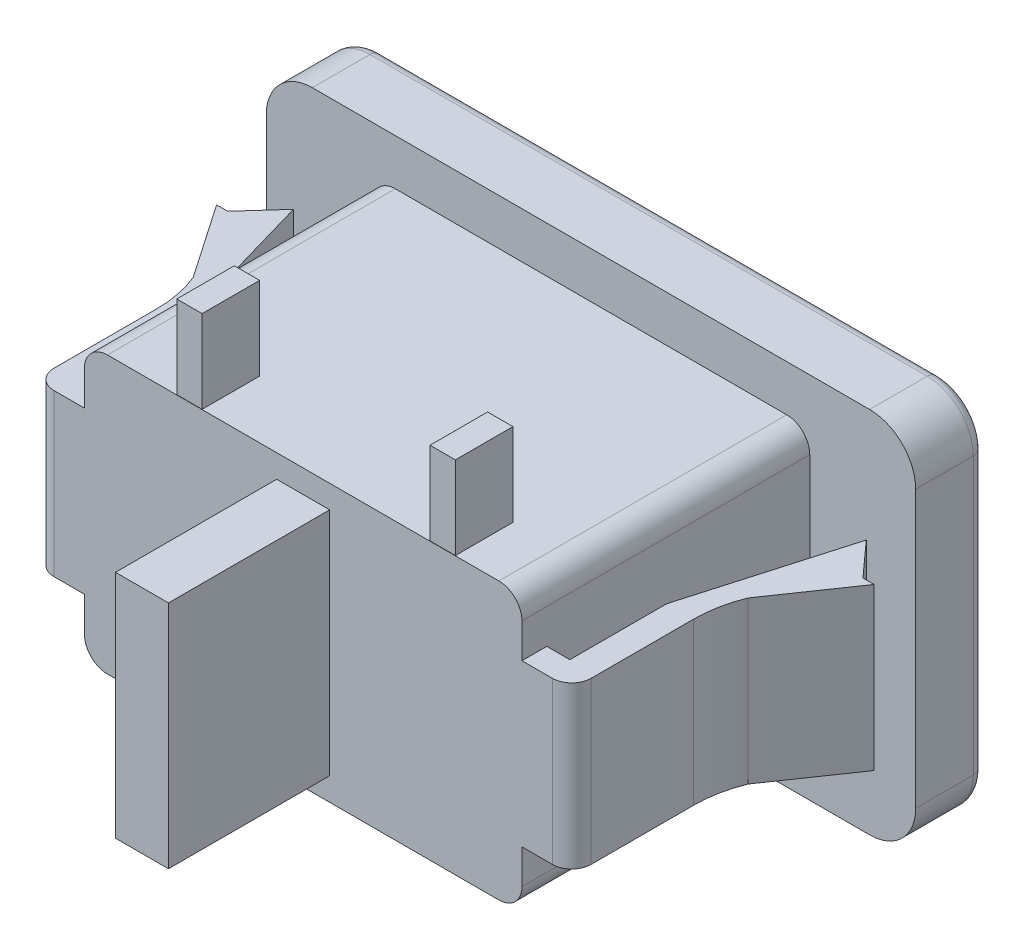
SolidWorks part; units mm, degrees
ref_plane "Front Plane" through (0, 0, 0) normal (0, 0, 1) x (1, 0, 0)
ref_plane "Top Plane" through (0, 0, 0) normal (0, 1, 0) x (1, 0, 0)
ref_plane "Center Plane" through (0, 0, 0) normal (1, 0, 0) x (0, 0, -1)
sketch "Sketch8" plane through (0, 0, 0) normal (0, 0, 1) x (1, 0, 0)
  line L0 (-1.1792, 0) -> (-1.2283, 0.4422)
  line L1 (-1.2283, 0.4422) -> (-1.2774, 0.737)
  line L2 (-1.3266, 0.8844) -> (-1.3757, 0.9826)
  line L3 (-1.4248, 1.13) -> (-1.474, 1.2774)
  line L4 (-1.474, 1.2774) -> (-1.6705, 1.6705)
  line L5 (-1.6705, 1.6705) -> (-1.7688, 1.7688)
  line L6 (-1.867, 1.9161) -> (-1.9161, 2.0144)
  line L7 (-2.0144, 2.0635) -> (-2.2601, 2.3583)
  line L8 (-2.2601, 2.3583) -> (-2.604, 2.604)
  line L9 (-2.7023, 2.6531) -> (-2.8005, 2.7023)
  line L10 (-2.9479, 2.8005) -> (-3.0462, 2.8497)
  line L11 (-3.0462, 2.8497) -> (-3.4392, 2.997)
  line L12 (-3.4392, 2.997) -> (-3.6849, 3.0462)
  line L13 (-3.7832, 3.0953) -> (-3.8814, 3.0953)
  line L14 (-3.8814, 3.0953) -> (-3.9306, 3.0953)
  line L15 (-4.0288, 3.0953) -> (-4.3236, 3.1444)
  line L16 (-4.3236, 3.1444) -> (-4.7658, 3.0953)
  line L17 (-4.7658, 3.0953) -> (-4.8149, 3.0953)
  line L18 (-4.9623, 3.0462) -> (-5.0606, 3.0462)
  line L19 (-5.208, 2.997) -> (-5.6502, 2.8497)
  line L20 (-5.6502, 2.8497) -> (-5.8958, 2.7023)
  line L21 (-6.0432, 2.6531) -> (-6.1415, 2.5549)
  line L22 (-6.2398, 2.4566) -> (-6.3872, 2.3583)
  line L23 (-6.3872, 2.3583) -> (-6.7311, 2.0144)
  line L24 (-6.7311, 2.0144) -> (-6.7802, 1.9653)
  line L25 (-6.8785, 1.8179) -> (-6.9276, 1.7196)
  line L26 (-7.0259, 1.6214) -> (-7.2224, 1.2774)
  line L27 (-7.2224, 1.2774) -> (-7.3207, 0.9335)
  line L28 (-7.3698, 0.8352) -> (-7.4189, 0.6878)
  line L29 (-7.4189, 0.5405) -> (-7.4681, 0.4422)
  line L30 (-7.4681, 0.4422) -> (-7.5172, 0)
  line L31 (-7.5172, 0) -> (-7.4681, -0.1965)
  line L32 (-7.4681, -0.3439) -> (-7.4681, -0.4913)
  line L33 (-7.4189, -0.5896) -> (-7.3698, -0.9335)
  line L34 (-7.3698, -0.9335) -> (-7.2224, -1.3266)
  line L35 (-7.2224, -1.3266) -> (-7.1733, -1.3266)
  line L36 (-7.1241, -1.474) -> (-7.075, -1.5722)
  line L37 (-7.0259, -1.6705) -> (-6.9767, -1.7196)
  line L38 (-6.9767, -1.7196) -> (-6.7311, -2.0635)
  line L39 (-6.7311, -2.0635) -> (-6.5345, -2.2601)
  line L40 (-6.4363, -2.3583) -> (-6.338, -2.4566)
  line L41 (-6.2398, -2.5057) -> (-6.0432, -2.6531)
  line L42 (-6.0432, -2.6531) -> (-5.6502, -2.8988)
  line L43 (-5.6502, -2.8988) -> (-5.5519, -2.8988)
  line L44 (-5.4536, -2.9479) -> (-5.3062, -2.997)
  line L45 (-5.208, -3.0462) -> (-4.7658, -3.1444)
  line L46 (-4.7658, -3.1444) -> (-4.4219, -3.1444)
  line L47 (-4.3236, -3.1936) -> (-4.1762, -3.1444)
  line L48 (-4.0288, -3.1444) -> (-3.8814, -3.1444)
  line L49 (-3.8814, -3.1444) -> (-3.4392, -3.0462)
  line L50 (-3.4392, -3.0462) -> (-3.2918, -2.997)
  line L51 (-3.1936, -2.9479) -> (-3.0462, -2.8988)
  line L52 (-2.9479, -2.8497) -> (-2.6531, -2.6531)
  line L53 (-2.6531, -2.6531) -> (-2.3092, -2.4075)
  line L54 (-2.2109, -2.3583) -> (-2.1127, -2.2109)
  line L55 (-2.0144, -2.1618) -> (-1.9653, -2.0635)
  line L56 (-1.9653, -2.0635) -> (-1.6705, -1.7196)
  line L57 (-1.6705, -1.7196) -> (-1.5722, -1.5231)
  line L58 (-1.474, -1.3757) -> (-1.474, -1.3266)
  line L59 (-1.474, -1.3266) -> (-1.4248, -1.2774)
  line L60 (-1.4248, -1.1792) -> (-1.3266, -0.9335)
  line L61 (-1.3266, -0.9335) -> (-1.2283, -0.4913)
  line L62 (-1.2283, -0.4913) -> (-1.2283, -0.3931)
  line L64 (-3.1936, 0) -> (-3.1936, 0.2457)
  line L65 (-3.1936, 0.2457) -> (-3.2918, 0.4913)
  line L66 (-3.2918, 0.4913) -> (-3.4392, 0.6878)
  line L67 (-3.5375, 0.8352) -> (-3.6358, 0.8844)
  line L68 (-3.7832, 0.9826) -> (-3.8323, 1.0318)
  line L69 (-3.8323, 1.0318) -> (-4.078, 1.0809)
  line L70 (-4.078, 1.0809) -> (-4.3236, 1.13)
  line L71 (-4.3236, 1.13) -> (-4.5201, 1.0809)
  line L72 (-4.6675, 1.0809) -> (-4.7658, 1.0318)
  line L73 (-4.9132, 0.9826) -> (-5.0606, 0.8844)
  line L74 (-5.0606, 0.8844) -> (-5.208, 0.6878)
  line L75 (-5.208, 0.6878) -> (-5.3554, 0.4913)
  line L76 (-5.3554, 0.4913) -> (-5.4045, 0.3931)
  line L77 (-5.4536, 0.2457) -> (-5.4536, 0.0983)
  line L78 (-5.5028, 0) -> (-5.4536, -0.2948)
  line L79 (-5.4536, -0.2948) -> (-5.3554, -0.5405)
  line L80 (-5.3554, -0.5405) -> (-5.208, -0.737)
  line L81 (-5.1097, -0.8352) -> (-5.0606, -0.9335)
  line L82 (-5.0606, -0.9335) -> (-5.0115, -0.9335)
  line L83 (-4.9132, -1.0318) -> (-4.8641, -1.0809)
  line L84 (-4.8641, -1.0809) -> (-4.5693, -1.13)
  line L85 (-4.5693, -1.13) -> (-4.3236, -1.1792)
  line L86 (-4.3236, -1.1792) -> (-4.1271, -1.13)
  line L87 (-4.0288, -1.13) -> (-3.8814, -1.0809)
  line L88 (-3.7832, -1.0318) -> (-3.6358, -0.9335)
  line L89 (-3.6358, -0.9335) -> (-3.4392, -0.737)
  line L90 (-3.4392, -0.737) -> (-3.2918, -0.5405)
  line L91 (-3.2918, -0.5405) -> (-3.2427, -0.4422)
  line L92 (-3.1936, -0.2948) -> (-3.1936, -0.1474)
  line L93 (-4.471, 4.2253) -> (-5.0115, 4.1762)
  line L94 (-5.0115, 4.1762) -> (-5.1589, 4.1762)
  line L95 (-5.3062, 4.1271) -> (-5.4045, 4.1271)
  line L96 (-5.5519, 4.078) -> (-5.601, 4.0288)
  line L97 (-5.601, 4.0288) -> (-6.1415, 3.8323)
  line L98 (-6.1415, 3.8323) -> (-6.2398, 3.7832)
  line L99 (-6.338, 3.734) -> (-6.4363, 3.6849)
  line L100 (-6.5837, 3.5866) -> (-6.6328, 3.5866)
  line L101 (-6.6328, 3.5866) -> (-7.075, 3.2427)
  line L102 (-7.075, 3.2427) -> (-7.1733, 3.1444)
  line L103 (-7.2715, 3.0462) -> (-7.3698, 2.9479)
  line L104 (-7.4189, 2.8988) -> (-7.5172, 2.8497)
  line L105 (-7.5172, 2.8497) -> (-7.8611, 2.4075)
  line L106 (-7.8611, 2.4075) -> (-7.9102, 2.3092)
  line L107 (-7.9594, 2.2109) -> (-8.0085, 2.0635)
  line L108 (-8.1068, 1.9653) -> (-8.1068, 1.9161)
  line L109 (-8.1068, 1.9161) -> (-8.3524, 1.3757)
  line L110 (-8.3524, 1.3757) -> (-8.4016, 1.2774)
  line L111 (-8.4016, 1.13) -> (-8.4507, 1.0318)
  line L112 (-8.4998, 0.9335) -> (-8.4998, 0.8352)
  line L113 (-8.4998, 0.8352) -> (-8.5981, 0.2457)
  line L114 (-8.5981, 0.2457) -> (-8.5981, 0.1474)
  line L115 (-8.5981, 0.0491) -> (-8.5981, -0.0983)
  line L116 (-8.5981, -0.1965) -> (-8.5981, -0.2948)
  line L117 (-8.5981, -0.2948) -> (-8.4998, -0.8844)
  line L118 (-8.4998, -0.8844) -> (-8.4998, -0.9335)
  line L119 (-8.4507, -1.0809) -> (-8.4016, -1.1792)
  line L120 (-8.4016, -1.3266) -> (-8.3524, -1.4248)
  line L121 (-8.3524, -1.4248) -> (-8.1068, -1.9653)
  line L122 (-8.1068, -1.9653) -> (-8.1068, -2.0144)
  line L123 (-8.0085, -2.1127) -> (-7.9594, -2.2601)
  line L124 (-7.9102, -2.3583) -> (-7.8611, -2.4566)
  line L125 (-7.8611, -2.4566) -> (-7.5172, -2.8988)
  line L126 (-7.5172, -2.8988) -> (-7.4189, -2.9479)
  line L127 (-7.3698, -3.0462) -> (-7.2715, -3.0953)
  line L128 (-7.1733, -3.1936) -> (-7.075, -3.2918)
  line L129 (-7.075, -3.2918) -> (-6.6328, -3.6358)
  line L130 (-6.6328, -3.6358) -> (-6.5837, -3.6849)
  line L131 (-6.4363, -3.734) -> (-6.338, -3.7832)
  line L132 (-6.2398, -3.8323) -> (-6.1415, -3.9306)
  line L133 (-6.1415, -3.9306) -> (-5.601, -4.1271)
  line L134 (-5.601, -4.1271) -> (-5.5519, -4.1271)
  line L135 (-5.4045, -4.1762) -> (-5.3062, -4.1762)
  line L136 (-5.1589, -4.2253) -> (-5.0115, -4.2253)
  line L137 (-5.0115, -4.2253) -> (-4.471, -4.2745)
  line L138 (-9.2859, 0) -> (-8.4016, 0)
  line L139 (-8.1559, 0) -> (-7.9102, 0)
  line L140 (-7.6646, 0) -> (-6.3872, 0)
  line L141 (-6.1415, 0) -> (-5.8958, 0)
  line L142 (-5.6502, 0) -> (-4.4219, 0)
  line L143 (-4.1271, 0) -> (-3.8814, 0)
  line L144 (-3.6358, 0) -> (-2.3583, 0)
  line L145 (-2.1127, 0) -> (-1.867, 0)
  line L150 (2.4075, 0) -> (3.6849, 0)
  line L151 (3.9306, 0) -> (4.1762, 0)
  line L152 (4.4219, 0) -> (5.6993, 0)
  line L153 (5.945, 0) -> (6.1906, 0)
  line L154 (6.4363, 0) -> (7.7137, 0)
  line L155 (7.9594, 0) -> (8.205, 0)
  line L156 (8.4507, 0) -> (9.2859, 0)
  line L157 (-6.2889, 0.7861) -> (-6.2889, 0.1474)
  line L158 (-6.2889, 0.0491) -> (-6.2889, -0.0983)
  line L159 (-6.2889, -0.1965) -> (-6.2889, -0.8352)
  line L160 (-6.2889, -0.8352) -> (-5.1589, -0.8352)
  line L161 (-6.2889, 0.7861) -> (-5.1589, 0.7861)
  line L162 (6.338, 0.7861) -> (6.338, 0.1474)
  line L163 (6.338, 0.0491) -> (6.338, -0.0983)
  line L164 (6.338, -0.1965) -> (6.338, -0.8352)
  line L165 (7.5172, 0) -> (7.4681, 0.4422)
  line L166 (7.4681, 0.4422) -> (7.4189, 0.737)
  line L167 (7.4189, 0.8844) -> (7.3698, 0.9826)
  line L168 (7.2715, 1.13) -> (7.2224, 1.2774)
  line L169 (7.2224, 1.2774) -> (7.0259, 1.6705)
  line L170 (7.0259, 1.6705) -> (6.9276, 1.7687)
  line L171 (6.8293, 1.9161) -> (6.7802, 2.0144)
  line L172 (6.6819, 2.0635) -> (6.4363, 2.3583)
  line L173 (6.4363, 2.3583) -> (6.0924, 2.604)
  line L174 (5.9941, 2.6531) -> (5.8958, 2.7023)
  line L175 (5.7484, 2.8005) -> (5.6993, 2.8497)
  line L176 (5.6993, 2.8497) -> (5.2571, 2.997)
  line L177 (5.2571, 2.997) -> (5.0606, 3.0462)
  line L178 (4.9132, 3.0953) -> (4.8149, 3.0953)
  line L179 (4.8149, 3.0953) -> (4.7658, 3.0953)
  line L180 (4.6675, 3.0953) -> (4.3727, 3.1444)
  line L181 (4.3727, 3.1444) -> (3.9306, 3.0953)
  line L182 (3.9306, 3.0953) -> (3.8814, 3.0953)
  line L183 (3.734, 3.0462) -> (3.6358, 3.0462)
  line L184 (3.4884, 2.997) -> (3.0462, 2.8497)
  line L185 (3.0462, 2.8497) -> (2.8005, 2.7023)
  line L186 (2.6531, 2.6531) -> (2.5549, 2.5549)
  line L187 (2.5057, 2.4566) -> (2.3092, 2.3583)
  line L188 (2.3092, 2.3583) -> (1.9653, 2.0144)
  line L189 (1.9653, 2.0144) -> (1.9161, 1.9653)
  line L190 (1.867, 1.8179) -> (1.7688, 1.7196)
  line L191 (1.6705, 1.6214) -> (1.5231, 1.2774)
  line L192 (1.5231, 1.2774) -> (1.3757, 0.9335)
  line L193 (1.3266, 0.8352) -> (1.2774, 0.6878)
  line L197 (1.2283, -0.3439) -> (1.2283, -0.4913)
  line L198 (1.2774, -0.5896) -> (1.3266, -0.9335)
  line L199 (1.3266, -0.9335) -> (1.5231, -1.3266)
  line L200 (1.5722, -1.474) -> (1.6214, -1.5722)
  line L201 (1.6705, -1.6705) -> (1.7196, -1.7196)
  line L202 (1.7196, -1.7196) -> (1.9653, -2.0635)
  line L203 (1.9653, -2.0635) -> (2.1618, -2.2601)
  line L204 (2.2601, -2.3583) -> (2.3092, -2.4075)
  line L205 (2.3092, -2.4075) -> (2.3583, -2.4566)
  line L206 (2.5057, -2.5057) -> (2.6531, -2.6531)
  line L207 (2.6531, -2.6531) -> (3.0462, -2.8988)
  line L208 (3.0462, -2.8988) -> (3.1444, -2.8988)
  line L209 (3.2427, -2.9479) -> (3.3901, -2.997)
  line L210 (3.4884, -3.0462) -> (3.9306, -3.1444)
  line L211 (3.9306, -3.1444) -> (4.2745, -3.1444)
  line L212 (4.4219, -3.1936) -> (4.5201, -3.1444)
  line L213 (4.6675, -3.1444) -> (4.8149, -3.1444)
  line L214 (4.8149, -3.1444) -> (5.2571, -3.0462)
  line L215 (5.2571, -3.0462) -> (5.4045, -2.997)
  line L216 (5.5519, -2.9479) -> (5.6502, -2.8988)
  line L217 (5.7484, -2.8497) -> (6.0924, -2.6531)
  line L218 (6.0924, -2.6531) -> (6.4363, -2.4075)
  line L219 (6.5345, -2.3583) -> (6.5837, -2.2109)
  line L220 (6.6819, -2.1618) -> (6.7311, -2.0635)
  line L221 (6.7311, -2.0635) -> (7.0259, -1.7196)
  line L222 (7.0259, -1.7196) -> (7.1241, -1.5231)
  line L223 (7.2224, -1.3757) -> (7.2224, -1.3266)
  line L224 (7.2224, -1.3266) -> (7.2715, -1.2774)
  line L225 (7.2715, -1.1792) -> (7.4189, -0.9335)
  line L226 (7.4189, -0.9335) -> (7.4681, -0.4913)
  line L227 (7.4681, -0.4913) -> (7.4681, -0.3931)
  line L228 (7.5172, -0.2948) -> (7.5172, -0.1474)
  line L229 (5.5028, 0) -> (5.5028, 0.2457)
  line L230 (5.5028, 0.2457) -> (5.4045, 0.4913)
  line L231 (5.4045, 0.4913) -> (5.2571, 0.6878)
  line L232 (5.1589, 0.8352) -> (5.0606, 0.8844)
  line L233 (4.9623, 0.9826) -> (4.8641, 1.0318)
  line L234 (4.8641, 1.0318) -> (4.6184, 1.0809)
  line L235 (4.6184, 1.0809) -> (4.3727, 1.13)
  line L236 (4.3727, 1.13) -> (4.1762, 1.0809)
  line L237 (4.0288, 1.0809) -> (3.9306, 1.0318)
  line L238 (3.7832, 0.9826) -> (3.6358, 0.8844)
  line L239 (3.6358, 0.8844) -> (3.4884, 0.6878)
  line L240 (3.4884, 0.6878) -> (3.341, 0.4913)
  line L241 (3.341, 0.4913) -> (3.2918, 0.3931)
  line L242 (3.2427, 0.2457) -> (3.2427, 0.0983)
  line L243 (3.2427, 0) -> (3.2427, -0.2948)
  line L244 (3.2427, -0.2948) -> (3.341, -0.5405)
  line L245 (3.341, -0.5405) -> (3.4884, -0.737)
  line L246 (3.5866, -0.8352) -> (3.6358, -0.9335)
  line L247 (3.6358, -0.9335) -> (3.6849, -0.9335)
  line L248 (3.7832, -1.0318) -> (3.8814, -1.0809)
  line L249 (3.8814, -1.0809) -> (4.1271, -1.13)
  line L250 (4.1271, -1.13) -> (4.3727, -1.1792)
  line L251 (4.3727, -1.1792) -> (4.5693, -1.13)
  line L252 (4.7167, -1.13) -> (4.8149, -1.0809)
  line L253 (4.9623, -1.0318) -> (5.0606, -0.9335)
  line L254 (5.0606, -0.9335) -> (5.2571, -0.737)
  line L255 (5.2571, -0.737) -> (5.4045, -0.5405)
  line L256 (5.4045, -0.5405) -> (5.4536, -0.4422)
  line L257 (5.5028, -0.2948) -> (5.5028, -0.1474)
  line L258 (4.5201, -4.2745) -> (5.0606, -4.2253)
  line L259 (5.0606, -4.2253) -> (5.208, -4.2253)
  line L260 (5.3062, -4.1762) -> (5.4536, -4.1762)
  line L261 (5.5519, -4.1271) -> (5.6502, -4.1271)
  line L262 (5.6502, -4.1271) -> (6.1415, -3.9306)
  line L263 (6.1415, -3.9306) -> (6.2889, -3.8323)
  line L264 (6.3872, -3.7832) -> (6.4854, -3.734)
  line L265 (6.5837, -3.6849) -> (6.6328, -3.6358)
  line L266 (6.6328, -3.6358) -> (7.1241, -3.2918)
  line L267 (7.1241, -3.2918) -> (7.2224, -3.1936)
  line L268 (7.2715, -3.0953) -> (7.3698, -3.0462)
  line L269 (7.4681, -2.9479) -> (7.5172, -2.8988)
  line L270 (7.5172, -2.8988) -> (7.8611, -2.4566)
  line L271 (7.8611, -2.4566) -> (7.9102, -2.3583)
  line L272 (8.0085, -2.2601) -> (8.0576, -2.1127)
  line L273 (8.1068, -2.0144) -> (8.1559, -1.9653)
  line L274 (8.1559, -1.9653) -> (8.4016, -1.4248)
  line L275 (8.4016, -1.4248) -> (8.4016, -1.3266)
  line L276 (8.4507, -1.1792) -> (8.4998, -1.0809)
  line L277 (8.4998, -0.9335) -> (8.549, -0.8844)
  line L278 (8.549, -0.8844) -> (8.5981, -0.2948)
  line L279 (8.5981, -0.2948) -> (8.5981, -0.1965)
  line L280 (8.5981, -0.0983) -> (8.5981, 0.0491)
  line L281 (8.5981, 0.1474) -> (8.5981, 0.2457)
  line L282 (8.5981, 0.2457) -> (8.549, 0.8352)
  line L283 (8.549, 0.8352) -> (8.4998, 0.9335)
  line L284 (8.4998, 1.0318) -> (8.4507, 1.13)
  line L285 (8.4016, 1.2774) -> (8.4016, 1.3757)
  line L286 (8.4016, 1.3757) -> (8.1559, 1.9161)
  line L287 (8.1559, 1.9161) -> (8.1068, 1.9653)
  line L288 (8.0576, 2.0635) -> (8.0085, 2.2109)
  line L289 (7.9102, 2.3092) -> (7.8611, 2.4075)
  line L290 (7.8611, 2.4075) -> (7.5172, 2.8497)
  line L291 (7.5172, 2.8497) -> (7.4681, 2.8988)
  line L292 (7.3698, 2.9479) -> (7.2715, 3.0462)
  line L293 (7.2224, 3.1444) -> (7.1241, 3.2427)
  line L294 (7.1241, 3.2427) -> (6.6328, 3.5866)
  line L295 (6.6328, 3.5866) -> (6.5837, 3.5866)
  line L296 (6.4854, 3.6849) -> (6.3872, 3.734)
  line L297 (6.2889, 3.7832) -> (6.1415, 3.8323)
  line L298 (6.1415, 3.8323) -> (5.6502, 4.0288)
  line L299 (5.6502, 4.0288) -> (5.5519, 4.078)
  line L300 (5.4536, 4.1271) -> (5.3062, 4.1271)
  line L301 (5.208, 4.1762) -> (5.0606, 4.1762)
  line L302 (5.0606, 4.1762) -> (4.5201, 4.2253)
  line L303 (4.3727, -1.2774) -> (4.3727, -0.3931)
  line L304 (4.3727, -0.1474) -> (4.3727, 0.0983)
  line L305 (4.3727, 0.3439) -> (4.3727, 1.2283)
  line L306 (-4.3236, -1.2774) -> (-4.3236, -0.3931)
  line L307 (-4.3236, -0.1474) -> (-4.3236, 0.0983)
  line L308 (-4.3236, 0.3439) -> (-4.3236, 1.2283)
  line L313 (0, -1.4248) -> (0, -2.2109)
  line L314 (1.6705, -4.0288) -> (1.7687, -4.1762)
  line L315 (1.7687, -4.1762) -> (1.9653, -4.2745)
  line L316 (1.9653, -4.2745) -> (2.1127, -4.2745)
  line L317 (-0.8844, -2.7514) -> (-1.1792, -3.2427)
  line L318 (-1.2283, -3.341) -> (-1.3266, -3.4392)
  line L319 (-1.3757, -3.5375) -> (-1.6214, -4.0288)
  line L320 (-4.471, -4.2745) -> (-4.0288, -4.2745)
  line L321 (-3.8814, -4.2745) -> (-3.7832, -4.2745)
  line L322 (-3.6358, -4.2745) -> (-2.8988, -4.2745)
  line L323 (-2.7514, -4.2745) -> (-2.6531, -4.2745)
  line L324 (-2.5057, -4.2745) -> (-2.1127, -4.2745)
  line L325 (-2.1127, -4.2745) -> (-1.9161, -4.2745)
  line L326 (-1.9161, -4.2745) -> (-1.7688, -4.1762)
  line L327 (-1.7688, -4.1762) -> (-1.6214, -4.0288)
  line L328 (0.9335, -2.7514) -> (0.737, -2.5057)
  line L329 (0.737, -2.5057) -> (0.5405, -2.3583)
  line L330 (0.5405, -2.3583) -> (0.2948, -2.2601)
  line L331 (0.2948, -2.2601) -> (0.1965, -2.2601)
  line L332 (0.0983, -2.2109) -> (0, -2.2109)
  line L333 (0, -2.2109) -> (-0.0491, -2.2109)
  line L334 (-0.1474, -2.2601) -> (-0.2457, -2.2601)
  line L335 (-0.2457, -2.2601) -> (-0.4913, -2.3583)
  line L336 (-0.4913, -2.3583) -> (-0.737, -2.5057)
  line L337 (-0.737, -2.5057) -> (-0.8844, -2.7514)
  line L338 (0.9335, -2.7514) -> (1.2283, -3.2427)
  line L339 (1.2774, -3.341) -> (1.3266, -3.4392)
  line L340 (1.3757, -3.5375) -> (1.6705, -4.0288)
  line L341 (5.208, -0.8352) -> (6.338, -0.8352)
  line L342 (2.1127, -4.2745) -> (2.5549, -4.2745)
  line L343 (2.6531, -4.2745) -> (2.8005, -4.2745)
  line L344 (2.9479, -4.2745) -> (3.6849, -4.2745)
  line L345 (3.8323, -4.2745) -> (3.9306, -4.2745)
  line L346 (4.078, -4.2745) -> (4.5201, -4.2745)
  line L347 (2.1127, 4.2253) -> (1.9653, 4.2253)
  line L348 (1.9653, 4.2253) -> (1.7687, 4.1271)
  line L349 (1.7687, 4.1271) -> (1.6705, 3.9797)
  line L350 (-0.8844, 2.7023) -> (-1.1792, 3.1936)
  line L351 (-1.2283, 3.2918) -> (-1.3266, 3.3901)
  line L352 (-1.3757, 3.4884) -> (-1.6214, 3.9797)
  line L353 (-4.471, 4.2253) -> (-4.0288, 4.2253)
  line L354 (-3.8814, 4.2253) -> (-3.7832, 4.2253)
  line L355 (-3.6358, 4.2253) -> (-2.8988, 4.2253)
  line L356 (-2.7514, 4.2253) -> (-2.6531, 4.2253)
  line L357 (-2.5057, 4.2253) -> (-2.1127, 4.2253)
  line L358 (-1.6214, 3.9797) -> (-1.7688, 4.1271)
  line L359 (-1.7688, 4.1271) -> (-1.9161, 4.2253)
  line L360 (-1.9161, 4.2253) -> (-2.1127, 4.2253)
  line L361 (0.9335, 2.7023) -> (1.2283, 3.1936)
  line L362 (1.2774, 3.2918) -> (1.3266, 3.3901)
  line L363 (1.3757, 3.4884) -> (1.6705, 3.9797)
  line L364 (-0.8844, 2.7023) -> (-0.737, 2.4566)
  line L365 (-0.737, 2.4566) -> (-0.4913, 2.3092)
  line L366 (-0.4913, 2.3092) -> (-0.2457, 2.2109)
  line L370 (0.1965, 2.2109) -> (0.2948, 2.2109)
  line L371 (0.2948, 2.2109) -> (0.5405, 2.3092)
  line L372 (0.5405, 2.3092) -> (0.737, 2.4566)
  line L373 (0.737, 2.4566) -> (0.9335, 2.7023)
  line L374 (5.208, 0.7861) -> (6.338, 0.7861)
  line L375 (2.1127, 4.2253) -> (2.5549, 4.2253)
  line L376 (2.6531, 4.2253) -> (2.8005, 4.2253)
  line L377 (2.9479, 4.2253) -> (3.6849, 4.2253)
  line L378 (3.8323, 4.2253) -> (3.9306, 4.2253)
  line L379 (4.078, 4.2253) -> (4.5201, 4.2253)
  line L380 (9.2859, 0) -> (-9.2859, 0)
  line L381 (0, 5.4932) -> (0, -5.2033)
sketch "Sketch9" plane through (0, 0, 0) normal (0, 1, 0) x (1, 0, 0)
  line L90 (-5.4202, -13.599) -> (-5.4202, -12.6311)
  line L91 (2.3714, -12.6311) -> (2.3714, -15.2444)
  line L92 (5.4202, -12.9215) -> (5.4202, -12.6311)
  line L93 (5.2267, -12.9215) -> (5.2267, -13.599)
  line L94 (6.6301, -13.115) -> (6.6301, -17.4222)
  line L95 (5.9042, -14.5185) -> (5.9042, -16.2123)
  line L96 (5.2267, -13.7926) -> (5.2267, -16.9382)
  line L97 (8.0336, -13.9377) -> (7.9852, -13.7926)
  line L98 (7.9852, -13.7926) -> (7.8884, -13.6474)
  line L99 (7.8884, -13.6474) -> (7.7432, -13.599)
  line L100 (7.7432, -17.1318) -> (7.8884, -17.1318)
  line L101 (7.8884, -17.1318) -> (7.9852, -16.9866)
  line L102 (7.9852, -16.9866) -> (8.0336, -16.8414)
  line L103 (8.0336, -13.9377) -> (8.0336, -16.8414)
  line L104 (7.356, -14.5185) -> (7.356, -16.2123)
  line L105 (8.3239, -15.3896) -> (5.2751, -15.3896)
  line L106 (7.7432, -17.1318) -> (4.2588, -17.1318)
  line L107 (7.7432, -13.599) -> (5.2267, -13.599)
  line L108 (5.9042, -16.2123) -> (6.2913, -16.4059)
  line L109 (6.2913, -16.4059) -> (6.6301, -16.4543)
  line L110 (6.6301, -16.4543) -> (7.0173, -16.4059)
  line L111 (7.0173, -16.4059) -> (7.356, -16.2123)
  line L112 (7.356, -14.5185) -> (7.0173, -14.3249)
  line L113 (7.0173, -14.3249) -> (6.6301, -14.2765)
  line L114 (6.6301, -14.2765) -> (6.2913, -14.3249)
  line L115 (6.2913, -14.3249) -> (5.9042, -14.5185)
  line L116 (5.4202, -12.9215) -> (2.3714, -12.9215)
  line L117 (2.3714, -15.2444) -> (4.2588, -17.1318)
  line L118 (1.2099, 0) -> (1.2099, -19.3096)
  line L119 (1.2099, -19.3096) -> (0, -19.3096)
  line L120 (13.9378, 3) -> (13.9378, 0)
  line L121 (12.4375, -0.4839) -> (13.7926, -1.9842)
  line L122 (13.7926, -1.9842) -> (14.2765, -1.9842)
  line L123 (12.0503, -5.2267) -> (11.6632, -7.2108)
  line L124 (10.5017, -11.4212) -> (9.7274, -11.4212)
  line L125 (11.6632, -7.2108) -> (11.6632, -11.6148)
  line L126 (10.5017, -7.2108) -> (10.5017, -11.4212)
  line L127 (10.6953, -12.6311) -> (11.0341, -12.5343)
  line L128 (11.0341, -12.5343) -> (11.276, -12.4375)
  line L129 (11.276, -12.4375) -> (11.4696, -12.1955)
  line L130 (11.4696, -12.1955) -> (11.6632, -11.9052)
  line L131 (11.6632, -11.9052) -> (11.6632, -11.6148)
  line L132 (12.4375, -0.4839) -> (10.5017, -7.2108)
  line L133 (14.2765, -1.9842) -> (12.0503, -5.2267)
  line L134 (9.7274, 0) -> (9.7274, -12.6311)
  line L135 (13.9378, 0) -> (0, 0)
  line L136 (10.6953, -12.6311) -> (-1.2583, -12.6311)
  line L137 (13.9378, 3) -> (0, 3)
  line L138 (-2.3714, -12.6311) -> (-2.3714, -15.2444)
  line L139 (-5.4202, -16.7931) -> (-5.4202, -14.0345)
  line L140 (-2.3714, -15.2444) -> (-4.3072, -17.1318)
  line L141 (-10.5017, -7.2108) -> (-10.5017, -11.4212)
  line L142 (-10.5017, -11.4212) -> (-9.7274, -11.4212)
  line L143 (-7.7432, -13.599) -> (-7.8884, -13.6474)
  line L144 (-7.8884, -13.6474) -> (-8.0336, -13.7926)
  line L145 (-8.0336, -13.7926) -> (-8.082, -13.9378)
  line L146 (-5.9526, -14.5185) -> (-6.2913, -14.3249)
  line L147 (-6.2913, -14.3249) -> (-6.6785, -14.2765)
  line L148 (-6.6785, -14.2765) -> (-7.0173, -14.3249)
  line L149 (-7.0173, -14.3249) -> (-7.356, -14.5185)
  line L150 (-8.082, -16.8414) -> (-8.0336, -16.9866)
  line L151 (-8.0336, -16.9866) -> (-7.8884, -17.1318)
  line L152 (-7.8884, -17.1318) -> (-7.7432, -17.1318)
  line L153 (-7.356, -14.5185) -> (-7.356, -16.2123)
  line L154 (-7.356, -16.2123) -> (-7.0173, -16.4059)
  line L155 (-7.0173, -16.4059) -> (-6.6785, -16.4543)
  line L156 (-6.6785, -16.4543) -> (-6.2913, -16.4059)
  line L157 (-6.2913, -16.4059) -> (-5.9526, -16.2123)
  line L158 (-5.9526, -14.5185) -> (-5.9526, -16.2123)
  line L159 (-6.6785, -13.115) -> (-6.6785, -17.4222)
  line L160 (-8.082, -13.9378) -> (-8.082, -16.8414)
  line L161 (-10.6953, -12.6311) -> (-1.2583, -12.6311)
  line L162 (-7.7432, -13.599) -> (-5.4202, -13.599)
  line L163 (-7.7432, -17.1318) -> (-4.3072, -17.1318)
  line L164 (-8.3239, -15.3896) -> (-5.3234, -15.3896)
  line L165 (-9.7274, 0) -> (-9.7274, -12.6311)
  line L166 (0, -19.3096) -> (-1.2583, -19.3096)
  line L167 (-1.2583, -19.3096) -> (-1.2583, 0)
  line L168 (-13.9861, 3) -> (-13.9861, 0)
  line L169 (-12.4375, -0.4839) -> (-13.7926, -1.9842)
  line L170 (-13.7926, -1.9842) -> (-14.2765, -1.9842)
  line L171 (-11.7116, -11.6148) -> (-11.7116, -7.2108)
  line L172 (-11.7116, -7.2108) -> (-12.0503, -5.2267)
  line L173 (-14.2765, -1.9842) -> (-12.0503, -5.2267)
  line L174 (-13.9861, 3) -> (0, 3)
  line L175 (-13.9861, 0) -> (0, 0)
  line L176 (-12.4375, -0.4839) -> (-10.5017, -7.2108)
  line L177 (-11.7116, -11.6148) -> (-11.6632, -11.9052)
  line L178 (-11.6632, -11.9052) -> (-11.518, -12.1955)
  line L179 (-11.518, -12.1955) -> (-11.276, -12.4375)
  line L180 (-11.276, -12.4375) -> (-11.0341, -12.5343)
  line L181 (-11.0341, -12.5343) -> (-10.6953, -12.6311)
  line L182 (2.3714, -11.4696) -> (2.323, -11.4696)
  line L183 (-2.081, -1.6938) -> (-2.081, -11.518)
  line L184 (-2.081, -11.518) -> (-7.4044, -11.518)
  line L185 (-7.4044, -1.6938) -> (-2.081, -1.6938)
  line L186 (-8.1304, 0) -> (-8.1304, -12.6311)
  line L187 (7.4044, -1.6938) -> (7.4044, -11.518)
  line L188 (7.4044, -11.518) -> (7.4044, -1.6938)
  line L189 (2.081, -1.6938) -> (2.081, -11.518)
  line L190 (2.081, -11.518) -> (2.081, -1.6938)
  line L191 (7.4044, -11.518) -> (2.081, -11.518)
  line L192 (2.081, -11.518) -> (7.4044, -11.518)
  line L193 (7.4044, -1.6938) -> (2.081, -1.6938)
  line L194 (2.081, -1.6938) -> (7.4044, -1.6938)
  line L195 (8.1304, 0) -> (8.1304, -12.6311)
  line L286 (-5.4202, -13.599) -> (-5.4202, -12.6311)
  line L287 (2.3714, -12.6311) -> (2.3714, -15.2444)
  line L288 (5.4202, -12.9215) -> (5.4202, -12.6311)
  line L289 (5.2267, -12.9215) -> (5.2267, -13.599)
  line L290 (6.6301, -13.115) -> (6.6301, -17.4222)
  line L291 (5.9042, -14.5185) -> (5.9042, -16.2123)
  line L292 (5.2267, -13.7926) -> (5.2267, -16.9382)
  line L293 (8.0336, -13.9377) -> (7.9852, -13.7926)
  line L294 (7.9852, -13.7926) -> (7.8884, -13.6474)
  line L295 (7.8884, -13.6474) -> (7.7432, -13.599)
  line L296 (7.7432, -17.1318) -> (7.8884, -17.1318)
  line L297 (7.8884, -17.1318) -> (7.9852, -16.9866)
  line L298 (7.9852, -16.9866) -> (8.0336, -16.8414)
  line L299 (8.0336, -13.9377) -> (8.0336, -16.8414)
  line L300 (7.356, -14.5185) -> (7.356, -16.2123)
  line L301 (8.3239, -15.3896) -> (5.2751, -15.3896)
  line L302 (7.7432, -17.1318) -> (4.2588, -17.1318)
  line L303 (7.7432, -13.599) -> (5.2267, -13.599)
  line L304 (5.9042, -16.2123) -> (6.2913, -16.4059)
  line L305 (6.2913, -16.4059) -> (6.6301, -16.4543)
  line L306 (6.6301, -16.4543) -> (7.0173, -16.4059)
  line L307 (7.0173, -16.4059) -> (7.356, -16.2123)
  line L308 (7.356, -14.5185) -> (7.0173, -14.3249)
  line L309 (7.0173, -14.3249) -> (6.6301, -14.2765)
  line L310 (6.6301, -14.2765) -> (6.2913, -14.3249)
  line L311 (6.2913, -14.3249) -> (5.9042, -14.5185)
  line L312 (5.4202, -12.9215) -> (2.3714, -12.9215)
  line L313 (2.3714, -15.2444) -> (4.2588, -17.1318)
  line L314 (1.2099, 0) -> (1.2099, -19.3096)
  line L315 (1.2099, -19.3096) -> (0, -19.3096)
  line L316 (13.9378, 3) -> (13.9378, 0)
  line L317 (12.4375, -0.4839) -> (13.7926, -1.9842)
  line L318 (13.7926, -1.9842) -> (14.2765, -1.9842)
  line L319 (12.0503, -5.2267) -> (11.6632, -7.2108)
  line L320 (10.5017, -11.4212) -> (9.7274, -11.4212)
  line L321 (11.6632, -7.2108) -> (11.6632, -11.6148)
  line L322 (10.5017, -7.2108) -> (10.5017, -11.4212)
  line L323 (10.6953, -12.6311) -> (11.0341, -12.5343)
  line L324 (11.0341, -12.5343) -> (11.276, -12.4375)
  line L325 (11.276, -12.4375) -> (11.4696, -12.1955)
  line L326 (11.4696, -12.1955) -> (11.6632, -11.9052)
  line L327 (11.6632, -11.9052) -> (11.6632, -11.6148)
  line L328 (12.4375, -0.4839) -> (10.5017, -7.2108)
  line L329 (14.2765, -1.9842) -> (12.0503, -5.2267)
  line L330 (9.7274, 0) -> (9.7274, -12.6311)
  line L331 (13.9378, 0) -> (0, 0)
  line L332 (10.6953, -12.6311) -> (-1.2583, -12.6311)
  line L333 (13.9378, 3) -> (0, 3)
  line L334 (-2.3714, -12.6311) -> (-2.3714, -15.2444)
  line L335 (-5.4202, -16.7931) -> (-5.4202, -14.0345)
  line L336 (-2.3714, -15.2444) -> (-4.3072, -17.1318)
  line L337 (-10.5017, -7.2108) -> (-10.5017, -11.4212)
  line L338 (-10.5017, -11.4212) -> (-9.7274, -11.4212)
  line L339 (-7.7432, -13.599) -> (-7.8884, -13.6474)
  line L340 (-7.8884, -13.6474) -> (-8.0336, -13.7926)
  line L341 (-8.0336, -13.7926) -> (-8.082, -13.9378)
  line L342 (-5.9526, -14.5185) -> (-6.2913, -14.3249)
  line L343 (-6.2913, -14.3249) -> (-6.6785, -14.2765)
  line L344 (-6.6785, -14.2765) -> (-7.0173, -14.3249)
  line L345 (-7.0173, -14.3249) -> (-7.356, -14.5185)
  line L346 (-8.082, -16.8414) -> (-8.0336, -16.9866)
  line L347 (-8.0336, -16.9866) -> (-7.8884, -17.1318)
  line L348 (-7.8884, -17.1318) -> (-7.7432, -17.1318)
  line L349 (-7.356, -14.5185) -> (-7.356, -16.2123)
  line L350 (-7.356, -16.2123) -> (-7.0173, -16.4059)
  line L351 (-7.0173, -16.4059) -> (-6.6785, -16.4543)
  line L352 (-6.6785, -16.4543) -> (-6.2913, -16.4059)
  line L353 (-6.2913, -16.4059) -> (-5.9526, -16.2123)
  line L354 (-5.9526, -14.5185) -> (-5.9526, -16.2123)
  line L355 (-6.6785, -13.115) -> (-6.6785, -17.4222)
  line L356 (-8.082, -13.9378) -> (-8.082, -16.8414)
  line L357 (-10.6953, -12.6311) -> (-1.2583, -12.6311)
  line L358 (-7.7432, -13.599) -> (-5.4202, -13.599)
  line L359 (-7.7432, -17.1318) -> (-4.3072, -17.1318)
  line L360 (-8.3239, -15.3896) -> (-5.3234, -15.3896)
  line L361 (-9.7274, 0) -> (-9.7274, -12.6311)
  line L362 (0, -19.3096) -> (-1.2583, -19.3096)
  line L363 (-1.2583, -19.3096) -> (-1.2583, 0)
  line L364 (-13.9861, 3) -> (-13.9861, 0)
  line L365 (-12.4375, -0.4839) -> (-13.7926, -1.9842)
  line L366 (-13.7926, -1.9842) -> (-14.2765, -1.9842)
  line L367 (-11.7116, -11.6148) -> (-11.7116, -7.2108)
  line L368 (-11.7116, -7.2108) -> (-12.0503, -5.2267)
  line L369 (-14.2765, -1.9842) -> (-12.0503, -5.2267)
  line L370 (-13.9861, 3) -> (0, 3)
  line L371 (-13.9861, 0) -> (0, 0)
  line L372 (-12.4375, -0.4839) -> (-10.5017, -7.2108)
  line L373 (-11.7116, -11.6148) -> (-11.6632, -11.9052)
  line L374 (-11.6632, -11.9052) -> (-11.518, -12.1955)
  line L375 (-11.518, -12.1955) -> (-11.276, -12.4375)
  line L376 (-11.276, -12.4375) -> (-11.0341, -12.5343)
  line L377 (-11.0341, -12.5343) -> (-10.6953, -12.6311)
  line L378 (2.3714, -11.4696) -> (2.323, -11.4696)
  line L379 (-2.081, -1.6938) -> (-2.081, -11.518)
  line L380 (-2.081, -11.518) -> (-7.4044, -11.518)
  line L381 (-7.4044, -11.518) -> (-7.4044, -1.6938)
  line L382 (-7.4044, -1.6938) -> (-2.081, -1.6938)
  line L383 (-8.1304, 0) -> (-8.1304, -12.6311)
  line L384 (7.4044, -1.6938) -> (7.4044, -11.518)
  line L385 (7.4044, -11.518) -> (7.4044, -1.6938)
  line L386 (2.081, -1.6938) -> (2.081, -11.518)
  line L387 (2.081, -11.518) -> (2.081, -1.6938)
  line L388 (7.4044, -11.518) -> (2.081, -11.518)
  line L389 (2.081, -11.518) -> (7.4044, -11.518)
  line L390 (7.4044, -1.6938) -> (2.081, -1.6938)
  line L391 (2.081, -1.6938) -> (7.4044, -1.6938)
  line L392 (8.1304, 0) -> (8.1304, -12.6311)
  dimension "D1" = 3
sketch "Sketch1" plane through (0, 0, 0) normal (0, 0, 1) x (1, 0, 0)
  line L1 (-12.1, -8) -> (12.1, -8)
  line L2 (-14.1, -6) -> (-14.1, 6)
  line L3 (-12.1, 8) -> (12.1, 8)
  line L4 (14.1, -6) -> (14.1, 6)
  line L5 (-14.1, -8) -> (14.1, 8) construction
  line L6 (-14.1, 8) -> (14.1, -8) construction
  arc A0 (12.1, 8) -> (14.1, 6) centre (12.1, 6) cw
  arc A1 (12.1, -8) -> (14.1, -6) centre (12.1, -6) ccw
  arc A2 (-12.1, -8) -> (-14.1, -6) centre (-12.1, -6) cw
  arc A3 (-14.1, 6) -> (-12.1, 8) centre (-12.1, 6) cw
  point P0 (0, 0)
  dimension "D3" = 2
  dimension "D1" = 28.2
  dimension "D2" = 16
extrude "Boss-Extrude1" add sketch "Sketch1" against normal blind 3
sketch "Sketch3" plane through (0, 0, 0) normal (0, 0, 1) x (1, 0, 0)
  line L1 (-8.5, -6) -> (8.5, -6)
  line L2 (-9.5, -5) -> (-9.5, 5)
  line L3 (-8.5, 6) -> (8.5, 6)
  line L4 (9.5, -5) -> (9.5, 5)
  line L5 (-9.5, -6) -> (9.5, 6) construction
  line L6 (-9.5, 6) -> (9.5, -6) construction
  arc A0 (-8.5, -6) -> (-9.5, -5) centre (-8.5, -5) cw
  arc A1 (8.5, -6) -> (9.5, -5) centre (8.5, -5) ccw
  arc A2 (8.5, 6) -> (9.5, 5) centre (8.5, 5) cw
  arc A3 (-9.5, 5) -> (-8.5, 6) centre (-8.5, 5) cw
  point P0 (0, 0)
  dimension "D3" = 1
  dimension "D1" = 19
  dimension "D2" = 12
extrude "Boss-Extrude3" add sketch "Sketch3" along normal blind 12.5
sketch "Sketch10" plane through (0, 0, 0) normal (0, 1, 0) x (1, 0, 0)
  line L0 (12.4375, -0.4839) -> (13.7926, -1.9842)
  line L1 (13.7926, -1.9842) -> (14.2765, -1.9842)
  line L2 (14.2765, -1.9842) -> (12.0503, -5.2267)
  line L3 (11.6632, -7.2108) -> (11.6632, -11.6148) construction
  line L4 (11.6632, -7.2108) -> (11.6632, -11.6586)
  line L5 (9.5, -12.5) -> (10.8218, -12.5)
  line L6 (10.5017, -11.4212) -> (9.5, -11.4212)
  line L7 (10.5017, -11.4212) -> (10.5017, -7.2108)
  line L8 (10.5017, -7.2108) -> (12.4375, -0.4839)
  line L9 (9.5, -12.5) -> (9.5, -11.4212)
  line L11 (0, 0) -> (0, -14.9569) construction
  line L12 (-9.5, -12.5) -> (-9.5, -11.4212)
  line L13 (-10.5017, -7.2108) -> (-12.4375, -0.4839)
  line L14 (-10.5017, -11.4212) -> (-10.5017, -7.2108)
  line L15 (-10.5017, -11.4212) -> (-9.5, -11.4212)
  line L16 (-9.5, -12.5) -> (-10.8218, -12.5)
  line L17 (-11.6632, -7.2108) -> (-11.6632, -11.6586)
  line L18 (-14.2765, -1.9842) -> (-12.0503, -5.2267)
  line L19 (-13.7926, -1.9842) -> (-14.2765, -1.9842)
  line L20 (-12.4375, -0.4839) -> (-13.7926, -1.9842)
  arc A0 (11.6632, -7.2108) -> (12.0503, -5.2267) centre (16.9413, -7.2108) cw
  arc A1 (10.8218, -12.5) -> (11.6632, -11.6586) centre (10.8218, -11.6586) ccw
  arc A2 (-10.8218, -12.5) -> (-11.6632, -11.6586) centre (-10.8218, -11.6586) cw
  arc A3 (-11.6632, -7.2108) -> (-12.0503, -5.2267) centre (-16.9413, -7.2108) ccw
extrude "Boss-Extrude7" add sketch "Sketch10" along normal mid plane 7
sketch "Sketch4" plane through (0, 0, -3) normal (0, 0, 1) x (1, 0, 0)
  line L0 (-4.15, 0) -> (4.15, 0) construction
  line L1 (-1.6454, 3.85) -> (-0.866, 2.5)
  line L2 (0.866, 2.5) -> (1.6454, 3.85)
  line L3 (-4.15, 4.1) -> (-2.0785, 4.1)
  line L4 (-4.15, -4.1) -> (-2.0785, -4.1)
  line L5 (2.0785, 4.1) -> (4.15, 4.1)
  line L6 (0.866, -2.5) -> (1.6454, -3.85)
  line L7 (-1.6454, -3.85) -> (-0.866, -2.5)
  line L8 (2.0785, -4.1) -> (4.15, -4.1)
  line L9 (0, 3) -> (0, -3) construction
  arc A0 (-4.15, 4.1) -> (-4.15, -4.1) centre (-4.15, 0) ccw
  arc A1 (4.15, -4.1) -> (4.15, 4.1) centre (4.15, 0) ccw
  arc A2 (-0.866, 2.5) -> (0.866, 2.5) centre (0, 3) ccw
  arc A3 (-0.866, -2.5) -> (0.866, -2.5) centre (0, -3) cw
  arc A4 (-1.6454, -3.85) -> (-2.0785, -4.1) centre (-2.0785, -3.6) cw
  arc A5 (1.6454, -3.85) -> (2.0785, -4.1) centre (2.0785, -3.6) ccw
  arc A6 (1.6454, 3.85) -> (2.0785, 4.1) centre (2.0785, 3.6) cw
  arc A7 (-1.6454, 3.85) -> (-2.0785, 4.1) centre (-2.0785, 3.6) ccw
  point P5 (8.25, 0)
  point P6 (-8.25, 0)
  point P22 (-1.7898, -4.1)
  point P25 (1.7898, -4.1)
  point P28 (1.7898, 4.1)
  point P31 (-1.7898, 4.1)
  dimension "D1" = 8.2
  dimension "D4" = 1
  dimension "D6" = 0.5
  dimension "D2" = 16.5
  dimension "D3" = 60
  dimension "D5" = 6
extrude "Cut-Extrude1" cut sketch "Sketch4" along normal blind 13.6
sketch "Sketch5" plane through (0, 0, 12.5) normal (0, 0, 1) x (1, 0, 0)
  line L1 (-1.15, -5) -> (1.15, -5)
  line L2 (-1.15, -5) -> (-1.15, 5)
  line L3 (-1.15, 5) -> (1.15, 5)
  line L4 (1.15, -5) -> (1.15, 5)
  line L5 (-1.15, -5) -> (1.15, 5) construction
  line L6 (-1.15, 5) -> (1.15, -5) construction
  point P0 (0, 0)
  dimension "D1" = 2.3
  dimension "D2" = 10
extrude "Boss-Extrude4" add sketch "Sketch5" along normal offset from surface (7 mm away) 22.5
sketch "Sketch7" plane through (0, 0, 10.6) normal (0, 0, -1) x (-1, 0, 0)
  line L0 (-4.3, 0) -> (4.3, 0) construction
  circle A0 centre (-4.3, 0) radius 3.15
  circle A1 centre (4.3, 0) radius 3.15
  dimension "D1" = 6.3
  dimension "D2" = 8.6
extrude "Boss-Extrude6" add sketch "Sketch7" along normal offset from surface (3.45 mm away) 10.15
sketch "Sketch6" plane through (0, 0, 7.15) normal (0, 0, -1) x (-1, 0, 0)
  line L0 (-4.3, 0) -> (4.3, 0) construction
  circle A0 centre (-4.3, 0) radius 1.18
  circle A1 centre (4.3, 0) radius 1.18
  dimension "D2" = 2.36
  dimension "D1" = 8.6
extrude "Boss-Extrude5" add sketch "Sketch6" along normal blind 9.1
fillet "Fillet3" radius 1.18 2 edges at (-5.48, 0, -1.95) (3.12, 0, -1.95)
fillet "Fillet4" radius 0.5 8 edges at (13.5142, -7.4142, -3) (0, -8, -3) (-13.5142, -7.4142, -3) (-14.1, 0, -3) (-13.5142, 7.4142, -3) (0, 8, -3) (13.5142, 7.4142, -3) (14.1, 0, -3)
sketch "Sketch11" [suppressed] plane through (0, 0, 0) normal (0, 1, 0) x (1, 0, 0)
  line L0 (2.3714, -12.6311) -> (2.3714, -15.2444)
  line L1 (2.3714, -15.2444) -> (4.2588, -17.1318)
  line L2 (4.2588, -17.1318) -> (7.7432, -17.1318)
  line L3 (5.2267, -12.6311) -> (5.2267, -13.599)
  line L4 (5.2267, -13.599) -> (7.7432, -13.599)
  line L5 (8.0336, -16.8414) -> (8.0336, -13.8894)
  line L6 (8.0336, -13.9377) -> (8.0336, -16.8414) construction
  line L7 (5.9042, -14.5185) -> (5.9042, -16.2123)
  line L8 (5.9042, -14.5185) -> (5.9042, -16.2123) construction
  line L9 (7.356, -14.5185) -> (7.356, -16.2123)
  line L10 (7.356, -14.5185) -> (7.356, -16.2123) construction
  line L11 (10.6953, -12.6311) -> (-1.2583, -12.6311) construction
  line L12 (2.3714, -12.6311) -> (5.2267, -12.6311)
  line L13 (0, 0) -> (0, -25.8848) construction
  line L14 (-2.3714, -12.6311) -> (-5.2267, -12.6311)
  line L15 (-7.356, -14.5185) -> (-7.356, -16.2123)
  line L16 (-5.9042, -14.5185) -> (-5.9042, -16.2123)
  line L17 (-8.0336, -16.8414) -> (-8.0336, -13.8894)
  line L18 (-5.2267, -13.599) -> (-7.7432, -13.599)
  line L19 (-5.2267, -12.6311) -> (-5.2267, -13.599)
  line L20 (-4.2588, -17.1318) -> (-7.7432, -17.1318)
  line L21 (-2.3714, -15.2444) -> (-4.2588, -17.1318)
  line L22 (-2.3714, -12.6311) -> (-2.3714, -15.2444)
  arc A0 (7.7432, -13.599) -> (8.0336, -13.8894) centre (7.7432, -13.8894) cw
  arc A1 (5.9042, -14.5185) -> (7.356, -14.5185) centre (6.6301, -15.4864) cw
  arc A2 (5.9042, -16.2123) -> (7.356, -16.2123) centre (6.6301, -15.2444) ccw
  arc A3 (8.0336, -16.8414) -> (7.7432, -17.1318) centre (7.7432, -16.8414) cw
  arc A4 (-8.0336, -16.8414) -> (-7.7432, -17.1318) centre (-7.7432, -16.8414) ccw
  arc A5 (-5.9042, -16.2123) -> (-7.356, -16.2123) centre (-6.6301, -15.2444) cw
  arc A6 (-5.9042, -14.5185) -> (-7.356, -14.5185) centre (-6.6301, -15.4864) ccw
  arc A7 (-7.7432, -13.599) -> (-8.0336, -13.8894) centre (-7.7432, -13.8894) ccw
move or copy body "Body-Move/Copy1" bodies to move or copy 115 114 placed by mates yes
sketch "Sketch14" plane through (0, 6, 0) normal (0, 1, 0) x (1, 0, 0)
  line L0 (-4.4, -12.49) -> (-4.4, -9.99)
  line L1 (6.6, -12.49) -> (5.5, -12.49)
  line L2 (6.6, -12.49) -> (6.6, -9.99)
  line L3 (6.6, -9.99) -> (5.5, -9.99)
  line L4 (5.5, -12.49) -> (5.5, -9.99)
  line L5 (-4.4, -12.49) -> (-5.5, -12.49)
  line L6 (-5.5, -12.49) -> (-5.5, -9.99)
  line L7 (-4.4, -9.99) -> (-5.5, -9.99)
  line L8 (8.5, -12.5) -> (-8.5, -12.5) construction
  dimension "D1" = 2
  dimension "D2" = 1.1
  dimension "D3" = 2.5
  dimension "D4" = 0.01
  dimension "D5" = 5.5
extrude "Boss-Extrude8" add sketch "Sketch14" along normal blind 3.6
equation "\"Weight(KG)\"= \"SW-Mass\" * 0.453"
